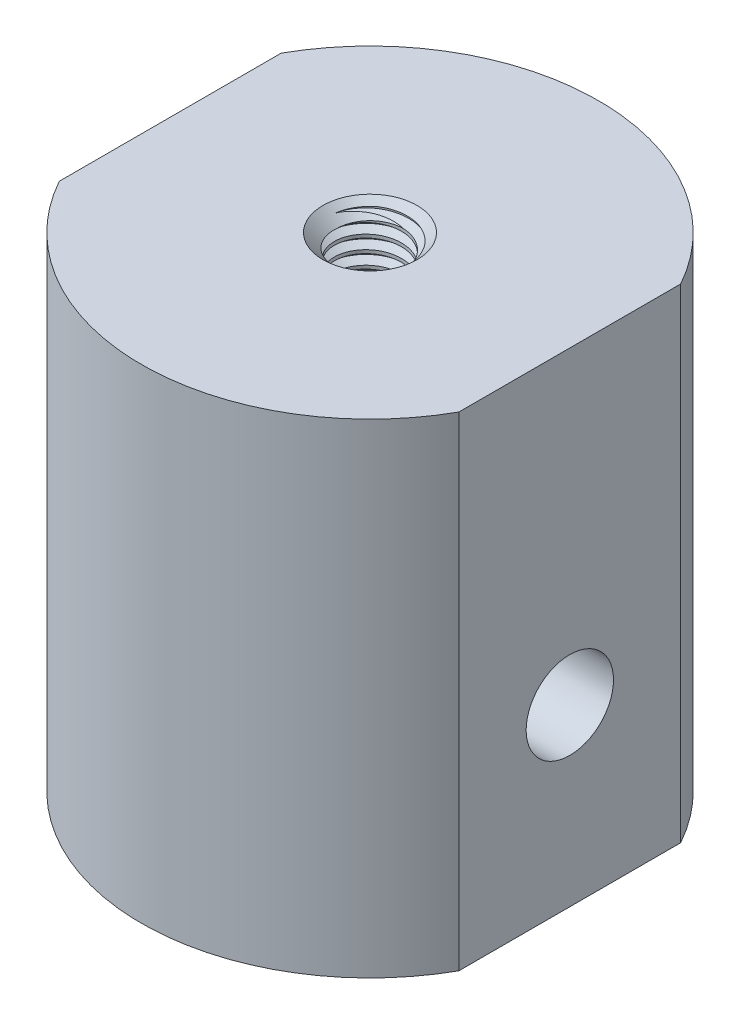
SolidWorks part; units mm, degrees
ref_plane "Front Plane" through (0, 0, 0) normal (0, 0, 1) x (1, 0, 0)
ref_plane "Top Plane" through (0, 0, 0) normal (0, 1, 0) x (1, 0, 0)
ref_plane "Right Plane" through (0, 0, 0) normal (1, 0, 0) x (0, 0, -1)
sketch "Sketch1" plane through (0, 0, 0) normal (0, 1, 0) x (1, 0, 0)
  circle A0 centre (0, 0) radius 10
  circle A1 centre (0, 0) radius 17
  dimension "D1" = 20
  dimension "D2" = 7
extrude "Boss-Extrude1" add sketch "Sketch1" along normal blind 24
sketch "Sketch2" plane through (0, 24, 0) normal (0, 1, 0) x (1, 0, 0)
  circle A0 centre (0, 0) radius 17
  circle A1 centre (0, 0) radius 17 construction
extrude "Boss-Extrude2" add sketch "Sketch2" along normal blind 12
sketch "Sketch3" plane through (0, 36, 0) normal (0, 1, 0) x (1, 0, 0)
  circle A0 centre (0, 0) radius 2.5
  dimension "D1" = 5
extrude "Cut-Extrude1" cut sketch "Sketch3" against normal through all
chamfer "Chamfer1" distance 1 angle 45 1 edges at (0, 36, 2.5)
thread "Thread1" pitch 1 start angle 0, offset 11, length 30, pitch 1, diameter 5
ref_plane "Plane1" through (-2.5, 46, 0) normal (0, 0, 1) x (-1, 0, 0)
sketch "Thread Profile1" plane through (-2.5, 46, 0) normal (0, 0, 1) x (-1, 0, 0)
  line L0 (0, 0) -> (0, 1) construction
  line L1 (0, 0) -> (0.5413, 0.3125)
  line L2 (0.5413, 0.3125) -> (0.5413, 0.4375)
  line L3 (0.5413, 0.4375) -> (0, 0.75)
  line L4 (0.5413, 0.375) -> (0, 0.375) construction
  line L11 (0, 0) -> (0, 0.75)
  point P2 (0, 0)
  dimension "Pitch" = 1
  dimension "Profile_Angle" = 60
  dimension "Profile_Land" = 0.125
  dimension "Profile_Height" = 0.5413
sketch "Sketch9" plane through (0, 0, 0) normal (1, 0, 0) x (0, 0, -1)
  line L0 (0, 24) -> (0, 0) construction
  line L2 (-10, 0) -> (10, 0) construction
  circle A0 centre (0, 13) radius 3.25
  dimension "D1" = 6.5
  dimension "D2" = 13
extrude "Cut-Extrude2" cut sketch "Sketch9" against normal through all and the other way through all
sketch "Sketch10" plane through (0, 36, 0) normal (0, 1, 0) x (1, 0, 0)
  line L0 (-14.864, 8.25) -> (-14.864, -8.25)
  line L1 (14.864, 8.25) -> (14.864, -8.25)
  line L2 (-9.4571, 3.25) -> (-16.6864, 3.25) construction
  line L3 (-16.6864, -3.25) -> (-9.4571, -3.25) construction
  line L4 (16.6864, 3.25) -> (9.4571, 3.25) construction
  line L5 (9.4571, -3.25) -> (16.6864, -3.25) construction
  arc A0 (14.864, -8.25) -> (14.864, 8.25) centre (0, 0) ccw
  circle A1 centre (0, 0) radius 17
  arc A2 (-14.864, 8.25) -> (-14.864, -8.25) centre (0, 0) ccw
  dimension "D2" = 5
  dimension "D3" = 5
  dimension "D4" = 5
  dimension "D5" = 5
  dimension "D1" = 0
extrude "Cut-Extrude3" cut sketch "Sketch10" against normal through all
